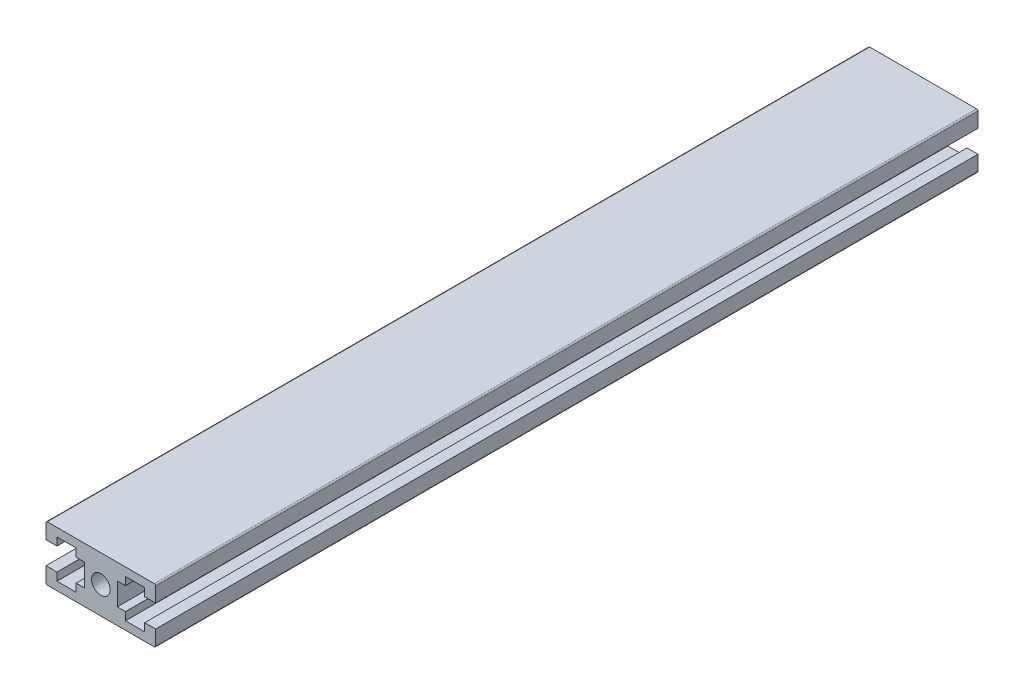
SolidWorks part; units mm, degrees
ref_plane "前视基准面" through (0, 0, 0) normal (0, 0, 1) x (1, 0, 0)
ref_plane "上视基准面" through (0, 0, 0) normal (0, 1, 0) x (1, 0, 0)
ref_plane "右视基准面" through (0, 0, 0) normal (1, 0, 0) x (0, 0, -1)
sketch "草图1" plane through (0, 0, 0) normal (0, 0, 1) x (1, 0, 0)
  line B0 (9, -7) -> (9, -4.1)
  line B1 (9, -4.1) -> (6, -4.1)
  line B2 (6, -4.1) -> (6, 4.1)
  line B3 (6, 4.1) -> (9, 4.1)
  line B4 (9, 4.1) -> (9, 7)
  line B5 (9, 7) -> (16, 7)
  line B6 (16, 7) -> (16, 4.1)
  line B7 (16, 4.1) -> (20, 4.1)
  line B8 (20, 4.1) -> (20, 9.5)
  line B9 (19.5, 10) -> (-19.5, 10)
  line B10 (-20, 9.5) -> (-20, 4.1)
  line B11 (-20, 4.1) -> (-16, 4.1)
  line B12 (-16, 4.1) -> (-16, 7)
  line B13 (-16, 7) -> (-9, 7)
  line B14 (-9, 7) -> (-9, 4.1)
  line B15 (-9, 4.1) -> (-6, 4.1)
  line B16 (-6, 4.1) -> (-6, -4.1)
  line B17 (-6, -4.1) -> (-9, -4.1)
  line B18 (-9, -4.1) -> (-9, -7)
  line B19 (-9, -7) -> (-16, -7)
  line B20 (-16, -7) -> (-16, -4.1)
  line B21 (-16, -4.1) -> (-20, -4.1)
  line B22 (-20, -4.1) -> (-20, -9.5)
  line B23 (-19.5, -10) -> (19.5, -10)
  line B24 (20, -9.5) -> (20, -4.1)
  line B25 (20, -4.1) -> (16, -4.1)
  line B26 (16, -4.1) -> (16, -7)
  line B27 (16, -7) -> (9, -7)
  arc B28 (20, 9.5) -> (19.5, 10) centre (19.5, 9.5) ccw
  arc B29 (-19.5, 10) -> (-20, 9.5) centre (-19.5, 9.5) ccw
  arc B30 (-20, -9.5) -> (-19.5, -10) centre (-19.5, -9.5) ccw
  arc B31 (19.5, -10) -> (20, -9.5) centre (19.5, -9.5) ccw
  circle B32 centre (0, 0) radius 3.4
sketch_block_instance "A$C451104A1-1"
sketch_block "A$C451104A1"
extrude "凸台-拉伸1" add sketch "草图1" along normal mid plane 300
